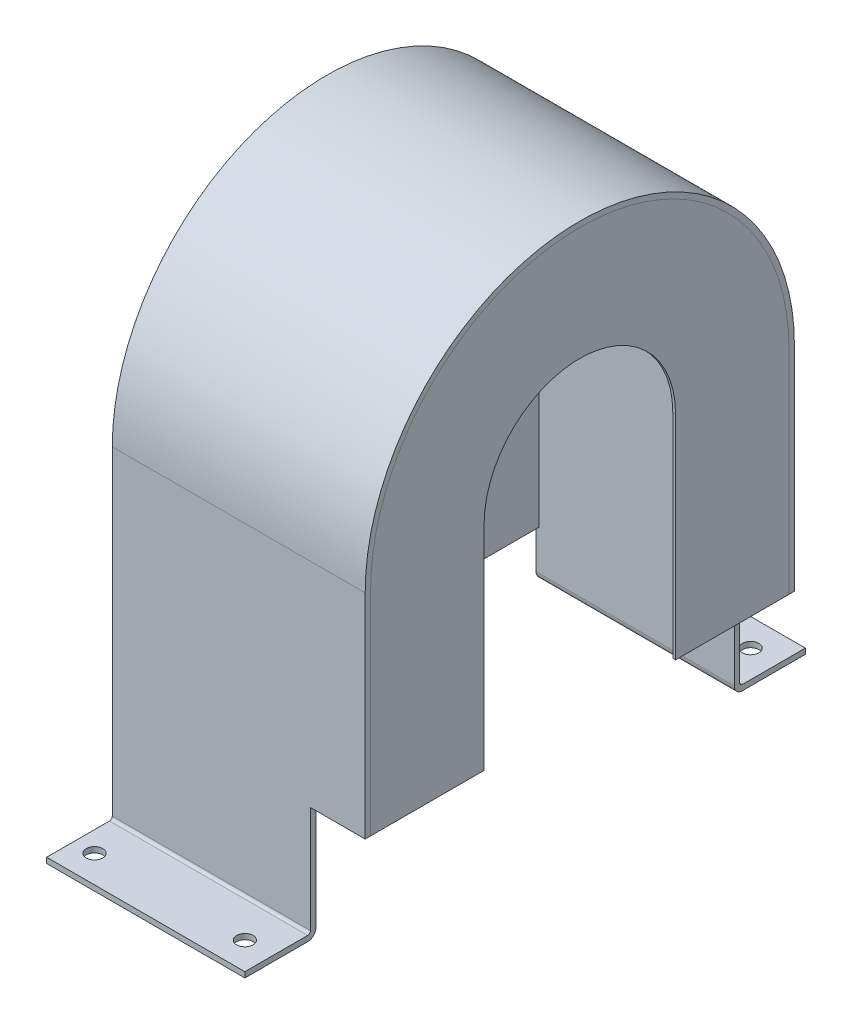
SolidWorks part; units mm, degrees
ref_plane "Front Plane" through (0, 0, 0) normal (0, 0, 1) x (1, 0, 0)
ref_plane "Top Plane" through (0, 0, 0) normal (0, 1, 0) x (1, 0, 0)
ref_plane "Right Plane" through (0, 0, 0) normal (1, 0, 0) x (0, 0, -1)
sketch "Sketch1" plane through (0, 0, 0) normal (1, 0, 0) x (0, 0, -1)
  line L0 (157, 0) -> (157, -234)
  line L1 (159, -236) -> (205, -236)
  line L2 (-157, 0) -> (-157, -234)
  line L3 (-159, -236) -> (-205, -236)
  line L4 (159, -240) -> (205, -240)
  line L5 (153, 0) -> (153, -234)
  line L6 (-153, 0) -> (-153, -234)
  line L7 (-159, -240) -> (-205, -240)
  line L8 (-205, -236) -> (-205, -240)
  line L9 (205, -236) -> (205, -240)
  arc A0 (157, 0) -> (-157, 0) centre (0, 0) ccw
  arc A1 (157, -234) -> (159, -236) centre (159, -234) ccw
  arc A2 (-157, -234) -> (-159, -236) centre (-159, -234) cw
  arc A3 (153, -234) -> (159, -240) centre (159, -234) ccw
  arc A4 (153, 0) -> (-153, 0) centre (0, 0) ccw
  arc A5 (-153, -234) -> (-159, -240) centre (-159, -234) cw
  arc A6 (157, 0) -> (-157, 0) centre (0, 0) ccw construction
  point P15 (-157, -236)
  dimension "D1" = 314
  dimension "D4" = 2
  dimension "D2" = 397
  dimension "D3" = 48
  dimension "D5" = 4
extrude "Boss-Extrude1" add sketch "Sketch1" along normal mid plane 185 contours A0 L2 A2 L3 L8 L7 A5 L6 A4 L5 A3 L4 L9 L1 A1 L0
sketch "Sketch2" plane through (92.5, 0, 0) normal (1, 0, 0) x (0, 0, -1)
  line L0 (-153, 0) -> (-153, -205)
  line L2 (-153, -205) -> (153, -205)
  line L4 (153, -205) -> (153, 0)
  line L5 (-153, 0) -> (-153, -234) construction
  line L6 (153, 0) -> (153, -234) construction
  line L7 (159, -240) -> (205, -240) construction
  arc A0 (-153, 0) -> (153, 0) centre (0, 0) cw
  arc A2 (153, 0) -> (-153, 0) centre (0, 0) ccw construction
  circle A3 centre (0, 0) radius 70
  dimension "D1" = 35
  dimension "D2" = 140
extrude "Boss-Extrude2" add sketch "Sketch2" against normal blind 2 separate body contours L2 L4 A0 L0 | A3
mirror "Mirror4" about plane through (0, 0, 0) normal (1, 0, 0)
sketch "Sketch3" plane through (0, -236, 0) normal (0, 1, 0) x (1, 0, 0)
  line L0 (32.5, -185) -> (-77.5, -185) construction
  line L1 (-92.5, -159) -> (-92.5, -205) construction
  line L2 (92.5, -205) -> (-92.5, -205) construction
  circle A0 centre (-77.5, -185) radius 6
  circle A1 centre (32.5, -185) radius 6
  dimension "D1" = 12
  dimension "D2" = 20
  dimension "D3" = 110
  dimension "D4" = 15
extrude "Cut-Extrude1" cut sketch "Sketch3" against normal through all
mirror "Mirror5" about plane through (0, 0, 0) normal (0, 0, 1) of "Cut-Extrude1"
sketch "Sketch4" plane through (-92.5, 0, 0) normal (-1, 0, 0) x (0, 0, 1)
  line L0 (70, 0) -> (70, -205)
  line L1 (153, -205) -> (-153, -205) construction
  line L2 (70, -205) -> (-70, -205)
  line L3 (-70, -205) -> (-70, 0)
  line L4 (-70, 0) -> (70, 0)
  circle A0 centre (0, 0) radius 70 construction
  dimension "D1" = 140
extrude "Cut-Extrude2" cut sketch "Sketch4" against normal through all
sketch "Sketch5" plane through (0, -236, 0) normal (0, 1, 0) x (1, 0, 0)
  line L0 (92.5, 205) -> (-92.5, 205) construction
  line L1 (92.5, -205) -> (52.5, -205)
  line L2 (92.5, -205) -> (92.5, 205)
  line L3 (92.5, 205) -> (52.5, 205)
  line L4 (52.5, -205) -> (52.5, 205)
  line L5 (92.5, -159) -> (92.5, -205) construction
  line L6 (92.5, -205) -> (-92.5, -205) construction
  dimension "D1" = 40
extrude "Cut-Extrude3" cut sketch "Sketch5" against normal blind 10 and the other way blind 80
sketch "Sketch6" plane through (92.5, 0, 0) normal (1, 0, 0) x (0, 0, -1)
  line L1 (-153, -205) -> (153, -205)
  line L2 (-153, -205) -> (-153, -156)
  line L3 (-153, -156) -> (153, -156)
  line L4 (153, -205) -> (153, -156)
extrude "Cut-Extrude4" cut sketch "Sketch6" against normal up to surface (2 mm away)
